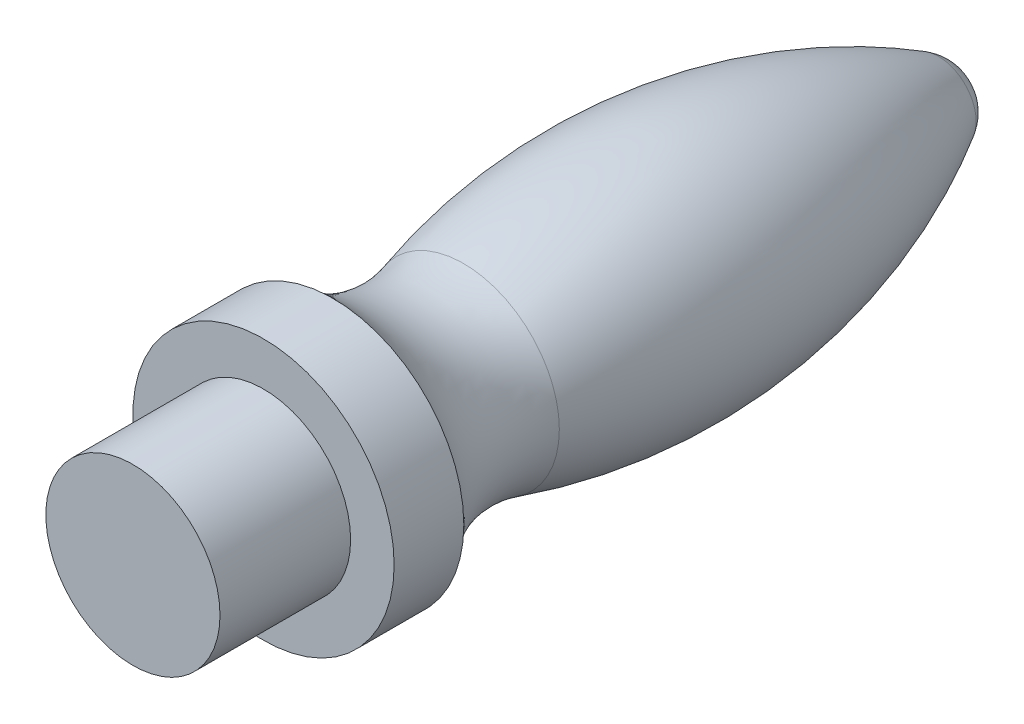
SolidWorks part; units mm, degrees
ref_plane "前视基准面" through (0, 0, 0) normal (0, 0, 1) x (1, 0, 0)
ref_plane "上视基准面" through (0, 0, 0) normal (0, 1, 0) x (1, 0, 0)
ref_plane "右视基准面" through (0, 0, 0) normal (1, 0, 0) x (0, 0, -1)
sketch "草图1" plane through (0, 0, 0) normal (1, 0, 0) x (0, 0, -1)
  line L0 (-68.4127, 0) -> (75.6196, 0) construction
  line L1 (-46.7337, 0) -> (-46.7337, 10)
  line L2 (-46.7337, 10) -> (-31.7337, 10)
  line L3 (-31.7337, 10) -> (-31.7337, 15)
  line L4 (-31.7337, 15) -> (-23.7337, 15)
  line L5 (-46.7337, 0) -> (48.2663, 0)
  arc A0 (-23.7337, 15) -> (-8.7681, 11.0022) centre (-12.9356, 25.4116) ccw
  arc A1 (48.2663, 0) -> (45.773, 4.3263) centre (43.2663, 0) ccw
  arc A2 (-8.7681, 11.0022) -> (45.773, 4.3263) centre (10.6802, -56.2418) cw
  dimension "D4" = 10
  dimension "D5" = 70
  dimension "D7" = 15
  dimension "D1" = 10
  dimension "D2" = 15
  dimension "D3" = 8
  dimension "D6" = 90
  dimension "D8" = 5
revolve "旋转1" add sketch "草图1" angle 360 about L0
